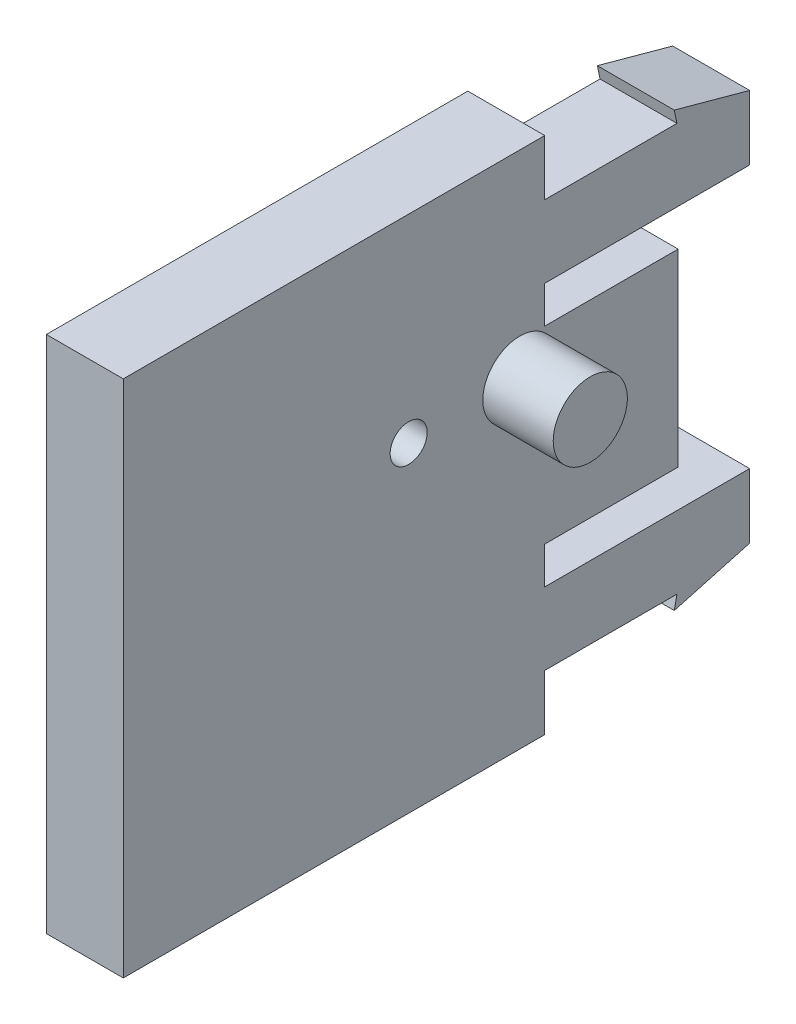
SolidWorks part; units mm, degrees
ref_plane "Plan de face" through (0, 0, 0) normal (0, 0, 1) x (1, 0, 0)
ref_plane "Plan de dessus" through (0, 0, 0) normal (0, 1, 0) x (1, 0, 0)
ref_plane "Plan de droite" through (0, 0, 0) normal (1, 0, 0) x (0, 0, -1)
sketch "Esquisse1" plane through (0, 0, 0) normal (0, 0, 1) x (1, 0, 0)
  line L1 (5.3531, 47.2496) -> (7.4288, 47.2496)
  line L2 (5.3531, 47.2496) -> (5.3531, 61.2496)
  line L3 (5.3531, 61.2496) -> (7.4288, 61.2496)
  line L4 (7.4288, 47.2496) -> (7.4288, 61.2496)
extrude "Extrusion1" add sketch "Esquisse1" along normal blind 15 and the other way blind 1.9
sketch "Esquisse2" plane through (7.4288, 0, 0) normal (1, 0, 0) x (0, 0, -1)
  line L0 (-3.6286, 56.7496) -> (-3.6286, 59.7496) construction
  line L1 (-5.2754, 54.2496) -> (5.1015, 54.2496) construction
  line L2 (-15, 61.2496) -> (1.9, 61.2496) construction
  line L3 (3.9108, 47.2496) -> (-0.0374, 47.2496)
  line L4 (2.3128, 49.0729) -> (2.3128, 50.7029)
  line L5 (-3.6286, 59.7496) -> (-0.0613, 59.7496)
  line L6 (-3.6286, 59.7496) -> (-3.6286, 61.2496)
  line L7 (-3.6286, 61.2496) -> (-0.0374, 61.2496)
  line L8 (-0.0286, 58.8996) -> (-0.7319, 66.8969) construction
  line L9 (-3.6286, 57.7963) -> (2.3128, 57.7963)
  line L10 (-3.6286, 57.7963) -> (-3.6286, 56.7963)
  line L11 (-3.6286, 56.7963) -> (-0.0286, 56.7963)
  line L12 (-0.0286, 57.8734) -> (-0.0286, 11.2258) construction
  line L14 (-0.1338, 48.4029) -> (2.3128, 49.0729)
  line L15 (-0.0613, 48.7496) -> (-0.1338, 48.4029)
  line L16 (-3.6286, 51.7029) -> (-0.0286, 51.7029)
  line L17 (-3.6286, 50.7029) -> (-3.6286, 51.7029)
  line L18 (-0.0613, 59.7496) -> (-0.1338, 60.0963)
  line L19 (-0.1338, 60.0963) -> (2.3128, 59.4262)
  line L20 (2.3128, 59.4262) -> (2.3128, 57.7963)
  line L21 (3.9108, 61.2496) -> (-0.0374, 61.2496)
  line L22 (-15, 47.2496) -> (1.9, 47.2496) construction
  line L23 (-5.2754, 61.2496) -> (-5.2754, 47.2496) construction
  line L24 (-3.6286, 50.7029) -> (2.3128, 50.7029)
  line L25 (-3.6286, 47.2496) -> (-0.0374, 47.2496)
  line L26 (-3.6286, 48.7496) -> (-3.6286, 47.2496)
  line L27 (-0.0286, 56.7963) -> (-0.0286, 51.7029)
  line L28 (3.9108, 61.2496) -> (3.9108, 47.2496)
  line L29 (-3.6286, 48.7496) -> (-0.0613, 48.7496)
  dimension "D1" = 2.3
  dimension "D2" = 1
extrude "Enlèv. mat.-Extru.3" cut sketch "Esquisse2" against normal through all
sketch "Esquisse3" plane through (7.4288, 0, 0) normal (1, 0, 0) x (0, 0, -1)
  line L1 (-15, 47.2496) -> (-15, 61.2496) construction
  line L3 (-15, 61.2496) -> (-3.6286, 61.2496) construction
  circle A0 centre (-4.3, 55.8996) radius 1
  dimension "D1" = 11.7
  dimension "D2" = 6.35
  dimension "D3" = 2
extrude "Extrusion2" add sketch "Esquisse3" along normal blind 1.9
sketch "Esquisse4" plane through (5.3531, 0, 0) normal (-1, 0, 0) x (0, 0, 1)
  line L2 (15, 61.2496) -> (15, 47.2496) construction
  line L4 (15, 61.2496) -> (3.6286, 61.2496) construction
  circle A0 centre (12.1, 55.9996) radius 1
  dimension "D1" = 2
  dimension "D2" = 3.9
  dimension "D3" = 6.25
extrude "Extrusion3" add sketch "Esquisse4" along normal blind 1.9
sketch "Esquisse5" plane through (5.3531, 0, 0) normal (-1, 0, 0) x (0, 0, 1)
  circle A0 centre (9.1, 55.9996) radius 0.5
  circle A3 centre (12.1, 55.9996) radius 1 construction
  dimension "D1" = 1
  dimension "D2" = 3.5
extrude "Enlèv. mat.-Extru.4" cut sketch "Esquisse5" against normal blind 1
sketch "Esquisse6" plane through (7.4288, 0, 0) normal (1, 0, 0) x (0, 0, -1)
  circle A0 centre (-7.3, 55.8996) radius 0.5
  circle A3 centre (-4.3, 55.8996) radius 1 construction
  dimension "D1" = 1
  dimension "D2" = 3.5
extrude "Enlèv. mat.-Extru.5" cut sketch "Esquisse6" against normal blind 1
